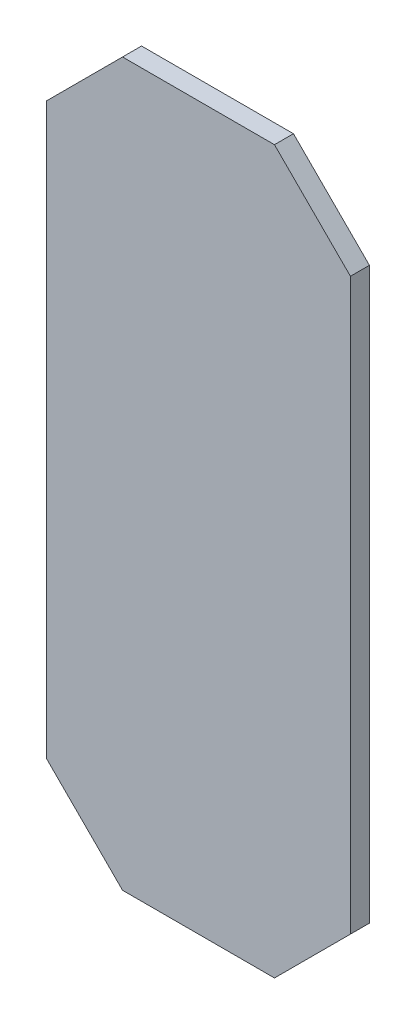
SolidWorks part; units mm, degrees
ref_plane "Přední" through (0, 0, 0) normal (0, 0, 1) x (1, 0, 0)
ref_plane "Horní" through (0, 0, 0) normal (0, 1, 0) x (1, 0, 0)
ref_plane "Pravá" through (0, 0, 0) normal (1, 0, 0) x (0, 0, -1)
sketch "Skica1" plane through (0, 0, 0) normal (0, 0, 1) x (1, 0, 0)
  line L0 (40, 95) -> (-40, -95) construction
  line L1 (-40, 95) -> (40, 95)
  line L2 (-40, 95) -> (-40, -95)
  line L3 (-40, -95) -> (40, -95)
  line L4 (40, 95) -> (40, -95)
  dimension "D1" = 80
  dimension "D2" = 190
extrude "Extrude1" add sketch "Skica1" along normal blind 5
chamfer "Zkosit1" distance 20 angle 45 4 edges at (40, -95, 2.5) (-40, -95, 2.5) (-40, 95, 2.5) (40, 95, 2.5)
